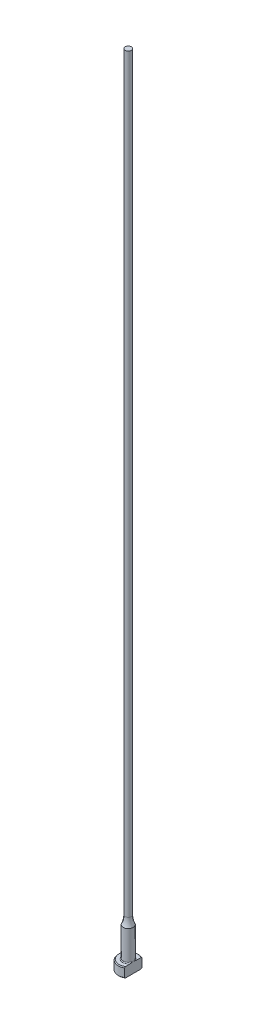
SolidWorks part; units mm, degrees
ref_plane "Front Plane" through (0, 0, 0) normal (0, 0, 1) x (1, 0, 0)
ref_plane "Top Plane" through (0, 0, 0) normal (0, 1, 0) x (1, 0, 0)
ref_plane "Right Plane" through (0, 0, 0) normal (1, 0, 0) x (0, 0, -1)
sketch "Sketch1" plane through (0, 0, 0) normal (0, 0, 1) x (1, 0, 0)
  line L0 (0, 259.9588) -> (0, -15.1925) construction
  line L1 (0, 0) -> (-3.175, 0)
  line L2 (-3.175, 0) -> (-3.175, 3.175)
  line L3 (-3.175, 3.175) -> (-1.5875, 3.175)
  line L4 (-0.9919, 15.3851) -> (-0.9919, 254)
  line L5 (-0.9919, 254) -> (0, 254)
  line L6 (0, 254) -> (0, 0)
  line L7 (-1.5875, 3.175) -> (-1.5875, 12.7)
  arc A0 (-1.5875, 12.7) -> (-0.9919, 15.3851) centre (-7.3419, 15.3851) ccw
  point P13 (-1.5875, 0)
  dimension "D1" = 6.35
  dimension "L" = 254
  dimension "D2" = 3.175
  dimension "H" = 6.35
  dimension "T" = 3.175
  dimension "D" = 1.9837
  dimension "S" = 12.7
revolve "Revolve1" add sketch "Sketch1" angle 360 about L0
chamfer "Chamfer1" distance 0.254 angle 45 2 edges at (0, 3.175, 3.175) (0, 0, 3.175)
fillet "Fillet1" radius 0.254 1 edges at (0, 3.175, 1.5875)
sketch "Sketch2" plane through (0, 0, 0) normal (0, 1, 0) x (1, 0, 0)
  line L0 (1.5875, -2.7496) -> (1.5875, 2.7496)
  circle A0 centre (0, 0) radius 3.175 construction
  arc A2 (1.5875, -2.7496) -> (1.5875, 2.7496) centre (0, 0) ccw
  circle A3 centre (0, 0) radius 3.175 construction
  circle A4 centre (0, 0) radius 1.5875 construction
extrude "Key Head" cut sketch "Sketch2" along normal up to next
